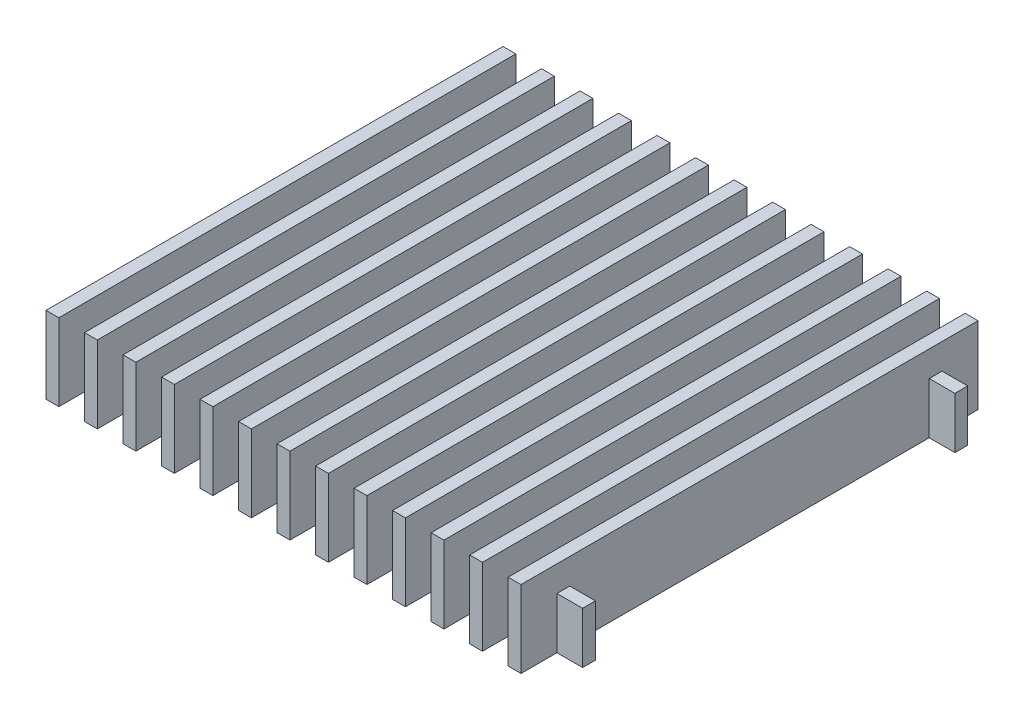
SolidWorks part; units mm, degrees
ref_plane "Front Plane" through (0, 0, 0) normal (0, 0, 1) x (1, 0, 0)
ref_plane "Top Plane" through (0, 0, 0) normal (0, 1, 0) x (1, 0, 0)
ref_plane "Right Plane" through (0, 0, 0) normal (1, 0, 0) x (0, 0, -1)
sketch "Sketch2" plane through (0, 0, 0) normal (0, 1, 0) x (1, 0, 0)
  line L0 (-49.2125, 56.515) -> (-46.0375, 56.515)
  line L1 (-65.0875, 56.515) -> (65.0875, 56.515) construction
  line L2 (-65.0875, 56.515) -> (-65.0875, -56.515) construction
  line L3 (-65.0875, -56.515) -> (65.0875, -56.515) construction
  line L4 (65.0875, 56.515) -> (65.0875, -56.515) construction
  line L5 (-65.0875, 56.515) -> (65.0875, -56.515) construction
  line L6 (-65.0875, -56.515) -> (65.0875, 56.515) construction
  line L7 (-58.7375, 56.515) -> (-55.5625, 56.515)
  line L8 (-58.7375, 56.515) -> (-58.7375, -56.515)
  line L9 (-58.7375, -56.515) -> (-55.5625, -56.515)
  line L10 (-55.5625, 56.515) -> (-55.5625, -56.515)
  line L11 (-49.2125, 56.515) -> (-49.2125, -56.515)
  line L12 (-46.0375, 56.515) -> (-46.0375, -56.515)
  line L13 (-49.2125, -56.515) -> (-46.0375, -56.515)
  line L14 (-39.6875, 56.515) -> (-36.5125, 56.515)
  line L15 (-39.6875, 56.515) -> (-39.6875, -56.515)
  line L16 (-36.5125, 56.515) -> (-36.5125, -56.515)
  line L17 (-39.6875, -56.515) -> (-36.5125, -56.515)
  line L18 (-30.1625, 56.515) -> (-26.9875, 56.515)
  line L19 (-30.1625, 56.515) -> (-30.1625, -56.515)
  line L20 (-26.9875, 56.515) -> (-26.9875, -56.515)
  line L21 (-30.1625, -56.515) -> (-26.9875, -56.515)
  line L22 (-20.6375, 56.515) -> (-17.4625, 56.515)
  line L23 (-20.6375, 56.515) -> (-20.6375, -56.515)
  line L24 (-17.4625, 56.515) -> (-17.4625, -56.515)
  line L25 (-20.6375, -56.515) -> (-17.4625, -56.515)
  line L26 (-11.1125, 56.515) -> (-7.9375, 56.515)
  line L27 (-11.1125, 56.515) -> (-11.1125, -56.515)
  line L28 (-7.9375, 56.515) -> (-7.9375, -56.515)
  line L29 (-11.1125, -56.515) -> (-7.9375, -56.515)
  line L30 (-1.5875, 56.515) -> (1.5875, 56.515)
  line L31 (-1.5875, 56.515) -> (-1.5875, -56.515)
  line L32 (1.5875, 56.515) -> (1.5875, -56.515)
  line L33 (-1.5875, -56.515) -> (1.5875, -56.515)
  line L34 (7.9375, 56.515) -> (11.1125, 56.515)
  line L35 (7.9375, 56.515) -> (7.9375, -56.515)
  line L36 (11.1125, 56.515) -> (11.1125, -56.515)
  line L37 (7.9375, -56.515) -> (11.1125, -56.515)
  line L38 (17.4625, 56.515) -> (20.6375, 56.515)
  line L39 (17.4625, 56.515) -> (17.4625, -56.515)
  line L40 (20.6375, 56.515) -> (20.6375, -56.515)
  line L41 (17.4625, -56.515) -> (20.6375, -56.515)
  line L42 (26.9875, 56.515) -> (30.1625, 56.515)
  line L43 (26.9875, 56.515) -> (26.9875, -56.515)
  line L44 (30.1625, 56.515) -> (30.1625, -56.515)
  line L45 (26.9875, -56.515) -> (30.1625, -56.515)
  line L46 (36.5125, 56.515) -> (39.6875, 56.515)
  line L47 (36.5125, 56.515) -> (36.5125, -56.515)
  line L48 (39.6875, 56.515) -> (39.6875, -56.515)
  line L49 (36.5125, -56.515) -> (39.6875, -56.515)
  line L50 (46.0375, 56.515) -> (49.2125, 56.515)
  line L51 (46.0375, 56.515) -> (46.0375, -56.515)
  line L52 (49.2125, 56.515) -> (49.2125, -56.515)
  line L53 (46.0375, -56.515) -> (49.2125, -56.515)
  line L54 (55.5625, 56.515) -> (58.7375, 56.515)
  line L55 (55.5625, 56.515) -> (55.5625, -56.515)
  line L56 (58.7375, 56.515) -> (58.7375, -56.515)
  line L57 (55.5625, -56.515) -> (58.7375, -56.515)
  point P0 (0, 0)
  dimension "D1" = 130.175
  dimension "D2" = 113.03
  dimension "D3" = 3.175
  dimension "D4" = 6.35
  dimension "D6" = 6.35
  dimension "D5" = 13
extrude "Boss-Extrude1" add sketch "Sketch2" along normal mid plane 19.05
sketch "Sketch3" plane through (0, -9.525, 0) normal (0, -1, 0) x (1, 0, 0)
  line L0 (65.0875, -56.515) -> (65.0875, 56.515) construction
  line L1 (-65.0875, 47.625) -> (65.0875, 47.625)
  line L2 (-65.0875, 47.625) -> (-65.0875, 44.45)
  line L3 (-65.0875, 44.45) -> (65.0875, 44.45)
  line L4 (65.0875, 47.625) -> (65.0875, 44.45)
  line L5 (-65.0875, -44.45) -> (65.0875, -44.45)
  line L6 (-65.0875, -44.45) -> (-65.0875, -47.625)
  line L7 (-65.0875, -47.625) -> (65.0875, -47.625)
  line L8 (65.0875, -44.45) -> (65.0875, -47.625)
  line L9 (-65.0875, -56.515) -> (-65.0875, 56.515) construction
  line L10 (0, 0) -> (-77.6403, 0) construction
  point P8 (-65.0875, -44.4229)
  point P11 (65.0875, 36.068)
  dimension "D1" = 88.9
  dimension "D2" = 3.175
extrude "Boss-Extrude2" add sketch "Sketch3" against normal blind 12.7
